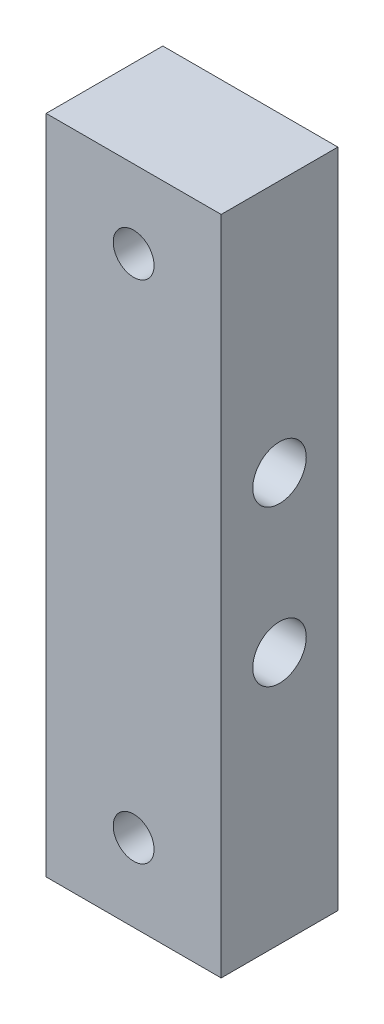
SolidWorks part; units mm, degrees
ref_plane "Face" through (0, 0, 0) normal (0, 0, 1) x (1, 0, 0)
ref_plane "Dessus" through (0, 0, 0) normal (0, 1, 0) x (1, 0, 0)
ref_plane "Droite" through (0, 0, 0) normal (1, 0, 0) x (0, 0, -1)
sketch "Esquisse1" plane through (0, 0, 0) normal (0, 0, 1) x (1, 0, 0)
  line L1 (0, 0) -> (18, 0)
  line L2 (0, 0) -> (0, 68)
  line L3 (0, 68) -> (18, 68)
  line L4 (18, 0) -> (18, 68)
  dimension "D1" = 18
  dimension "D2" = 68
extrude "Extrusion1" add sketch "Esquisse1" along normal blind 12
hole_wizard "Dégagement M51" positions "Esquisse3" profile "Esquisse2" hole size "M5" standard "ISO"
sketch "Esquisse3" plane through (18, 0, 0) normal (1, 0, 0) x (0, 0, -1)
  line L0 (-12, 0) -> (0, 0) construction
  line L1 (-12, 0) -> (-12, 68) construction
  point P0 (-6, 42)
  point P1 (-6, 26)
  dimension "D1" = 16
  dimension "D2" = 26
  dimension "D3" = 6
  dimension "D4" = 6
sketch "Esquisse2" plane through (18, 42, 6) normal (0, 1, 0) x (0, 0, -1)
  line L0 (0, 0) -> (0, 18)
  line L1 (0, 18) -> (2.75, 18)
  line L2 (2.75, 18) -> (2.75, 0)
  line L5 (2.75, 0) -> (0, 0)
  line L11 (0, -6.35) -> (0, 107.95) construction
  dimension "Diamètre du perçage jusqu'au prochain" = 5.5
  dimension "Profondeur du perçage jusqu'au prochain" = 18
hole_wizard "Trou taraudé M51" positions "Esquisse3D1" profile "Esquisse4" tap size "M5" standard "ISO"
sketch3d "Esquisse3D1"
  line L0 (18, 0, 12) -> (18, 68, 12) construction
  line L1 (18, 68, 12) -> (0, 68, 12) construction
  line L2 (0, 0, 12) -> (18, 0, 12) construction
  point P0 (9, 60, 12)
  point P2 (9, 8, 12)
  dimension "D1" = 9
  dimension "D2" = 9
  dimension "D3" = 8
  dimension "D4" = 8
sketch "Esquisse4" plane through (9, 60, 12) normal (1, 0, 0) x (0, -1, 0)
  line L0 (0, 0) -> (0, 12)
  line L1 (0, 12) -> (2.1, 12)
  line L2 (2.1, 12) -> (2.1, 0)
  line L5 (2.1, 0) -> (0, 0)
  line L11 (0, -6.35) -> (0, 107.95) construction
  dimension "Diamètre du trou pour taraudage jusqu'au prochain" = 4.2
  dimension "Profondeur du trou pour taraudage jusqu'au prochain" = 12
